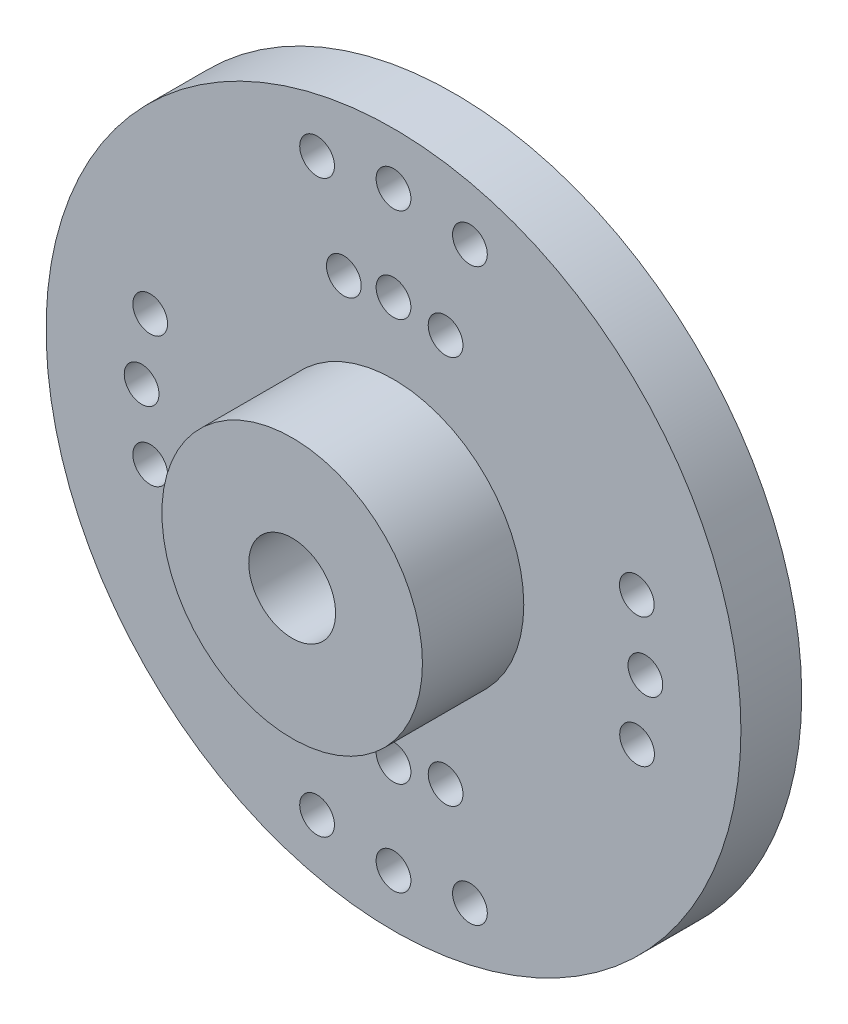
SolidWorks part; units mm, degrees
ref_plane "Face" through (0, 0, 0) normal (0, 0, 1) x (1, 0, 0)
ref_plane "Dessus" through (0, 0, 0) normal (0, 1, 0) x (1, 0, 0)
ref_plane "Droite" through (0, 0, 0) normal (1, 0, 0) x (0, 0, -1)
sketch "Esquisse1" plane through (0, 0, 0) normal (0, 0, 1) x (1, 0, 0)
  circle A0 centre (0, 0) radius 12
  dimension "D1" = 24
extrude "Extrusion1" add sketch "Esquisse1" along normal blind 2.1
sketch "Esquisse2" plane through (0, 0, 2.1) normal (0, 0, 1) x (1, 0, 0)
  circle A0 centre (0, 0) radius 4.5
  circle A1 centre (0, 0) radius 12 construction
  dimension "D1" = 9
extrude "Extrusion2" add sketch "Esquisse2" along normal blind 3.5
sketch "Esquisse3" plane through (0, 0, 0) normal (0, 0, -1) x (-1, 0, 0)
  line L0 (0, 12) -> (0, -12) construction
  line L1 (-12, 0) -> (12, 0) construction
  line L2 (-11.5913, -3.1051) -> (11.5909, 3.1065) construction
  line L3 (11.5911, -3.106) -> (-11.5912, 3.1057) construction
  line L4 (-3.1058, 11.5911) -> (3.1058, -11.5911) construction
  line L5 (3.1054, 11.5912) -> (-3.1062, -11.591) construction
  circle A0 centre (0, 0) radius 1.5
  circle A1 centre (0, 0) radius 12 construction
  circle A3 centre (-2.6399, 9.8524) radius 0.6
  circle A4 centre (0, 10.2) radius 0.6
  circle A5 centre (2.6396, 9.8526) radius 0.6
  circle A6 centre (-2.6404, -9.8523) radius 0.6
  circle A7 centre (0, -10.2) radius 0.6
  circle A8 centre (2.64, -9.8524) radius 0.6
  circle A9 centre (-1.7988, 6.7132) radius 0.6
  circle A10 centre (0, 6.95) radius 0.6
  circle A11 centre (1.7152, 6.735) radius 0.6
  circle A12 centre (-1.7992, -6.7131) radius 0.6
  circle A13 centre (1.7988, -6.7132) radius 0.6
  circle A14 centre (0, -6.95) radius 0.6
  circle A15 centre (-8.4035, 2.2515) radius 0.6
  circle A16 centre (-8.6999, 0) radius 0.6
  circle A17 centre (-8.4124, -2.218) radius 0.6
  circle A18 centre (8.4033, 2.2524) radius 0.6
  circle A19 centre (8.6999, 0) radius 0.6
  circle A20 centre (8.4034, -2.2519) radius 0.6
  dimension "D1" = 3
  dimension "D7" = 1.2
  dimension "D2" = 15
  dimension "D3" = 15
  dimension "D4" = 15
  dimension "D5" = 15
extrude "Enlèv. mat.-Extru.1" cut sketch "Esquisse3" against normal through all
